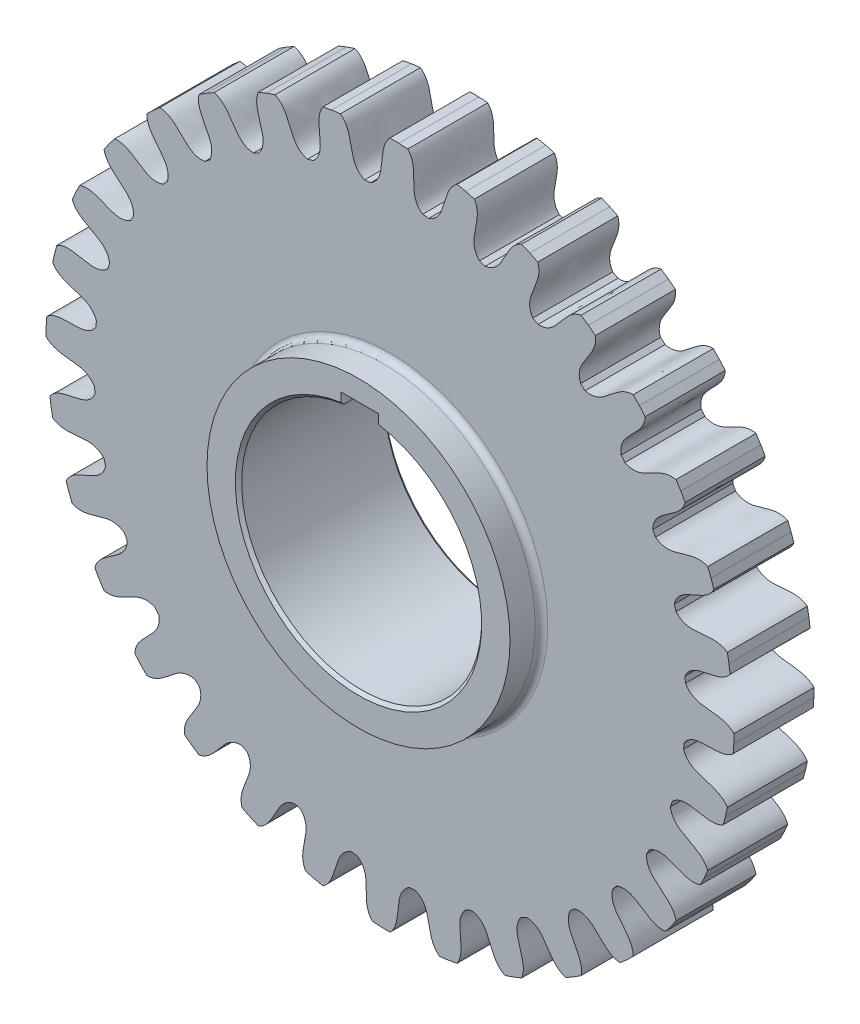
SolidWorks part; units mm, degrees
ref_plane "Ebene vorne" through (0, 0, 0) normal (0, 0, 1) x (1, 0, 0)
ref_plane "Ebene oben" through (0, 0, 0) normal (0, 1, 0) x (1, 0, 0)
ref_plane "Ebene rechts" through (0, 0, 0) normal (1, 0, 0) x (0, 0, -1)
ref_plane "Ebene1" through (0, 0, 13.081) normal (0, 0, 1) x (1, 0, 0)
sketch "Skizze1" plane through (0, 0, 13.081) normal (0, 0, 1) x (1, 0, 0)
  line L0 (22.8551, 51.3844) -> (21.5214, 51.9571)
  line L1 (13.7916, 54.4737) -> (12.3913, 54.8559)
  line L2 (12.3913, 54.8559) -> (10.9715, 55.1574)
  line L3 (2.8993, 56.1176) -> (1.4514, 56.2193)
  line L4 (1.4514, 56.2193) -> (0, 56.238)
  line L5 (-8.1044, 55.6049) -> (-9.5444, 55.4222)
  line L6 (-9.5444, 55.4222) -> (-10.9715, 55.1574)
  line L7 (-18.7967, 52.9554) -> (-20.1733, 52.4952)
  line L8 (-20.1733, 52.4952) -> (-21.5214, 51.9571)
  line L9 (-28.7666, 48.2708) -> (-30.027, 47.5509)
  line L10 (-30.027, 47.5509) -> (-31.2442, 46.7602)
  line L11 (-37.631, 41.7312) -> (-38.7268, 40.7793)
  line L12 (-38.7268, 40.7793) -> (-39.7663, 39.7663)
  line L13 (-45.0493, 33.5879) -> (-45.9383, 32.4405)
  line L14 (-45.9383, 32.4405) -> (-46.7602, 31.2442)
  line L15 (-50.7364, 24.1539) -> (-51.3844, 22.8551)
  line L16 (-51.3844, 22.8551) -> (-51.9571, 21.5214)
  line L17 (-54.4737, 13.7916) -> (-54.8559, 12.3913)
  line L18 (-54.8559, 12.3913) -> (-55.1574, 10.9715)
  line L19 (-56.1176, 2.8993) -> (-56.2193, 1.4514)
  line L20 (-56.2193, 1.4514) -> (-56.238, 0)
  line L21 (-55.6049, -8.1044) -> (-55.4222, -9.5444)
  line L22 (-55.4222, -9.5444) -> (-55.1574, -10.9715)
  line L23 (-52.9554, -18.7967) -> (-52.4952, -20.1733)
  line L24 (-52.4952, -20.1733) -> (-51.9571, -21.5214)
  line L25 (-48.2708, -28.7666) -> (-47.5509, -30.027)
  line L26 (-47.5509, -30.027) -> (-46.7602, -31.2442)
  line L27 (-41.7312, -37.631) -> (-40.7793, -38.7268)
  line L28 (-40.7793, -38.7268) -> (-39.7663, -39.7663)
  line L29 (-33.5879, -45.0493) -> (-32.4405, -45.9383)
  line L30 (-32.4405, -45.9383) -> (-31.2442, -46.7602)
  line L31 (-24.1539, -50.7364) -> (-22.8551, -51.3844)
  line L32 (-22.8551, -51.3844) -> (-21.5214, -51.9571)
  line L33 (-13.7916, -54.4737) -> (-12.3913, -54.8559)
  line L34 (-12.3913, -54.8559) -> (-10.9715, -55.1574)
  line L35 (-2.8993, -56.1176) -> (-1.4514, -56.2193)
  line L36 (-1.4514, -56.2193) -> (0, -56.238)
  line L37 (8.1044, -55.6049) -> (9.5444, -55.4222)
  line L38 (9.5444, -55.4222) -> (10.9715, -55.1574)
  line L39 (18.7967, -52.9554) -> (20.1733, -52.4952)
  line L40 (20.1733, -52.4952) -> (21.5214, -51.9571)
  line L41 (28.7666, -48.2708) -> (30.027, -47.5509)
  line L42 (30.027, -47.5509) -> (31.2442, -46.7602)
  line L43 (37.631, -41.7312) -> (38.7268, -40.7793)
  line L44 (38.7268, -40.7793) -> (39.7663, -39.7663)
  line L45 (45.0493, -33.5879) -> (45.9383, -32.4405)
  line L46 (45.9383, -32.4405) -> (46.7602, -31.2442)
  line L47 (50.7364, -24.1539) -> (51.3844, -22.8551)
  line L48 (51.3844, -22.8551) -> (51.9571, -21.5214)
  line L49 (54.4737, -13.7916) -> (54.8559, -12.3913)
  line L50 (54.8559, -12.3913) -> (55.1574, -10.9715)
  line L51 (56.1176, -2.8993) -> (56.2193, -1.4514)
  line L52 (56.2193, -1.4514) -> (56.238, 0)
  line L53 (55.6049, 8.1044) -> (55.4222, 9.5444)
  line L54 (55.4222, 9.5444) -> (55.1574, 10.9715)
  line L55 (52.9554, 18.7967) -> (52.4952, 20.1733)
  line L56 (52.4952, 20.1733) -> (51.9571, 21.5214)
  line L57 (48.2708, 28.7666) -> (47.5509, 30.027)
  line L58 (47.5509, 30.027) -> (46.7602, 31.2442)
  line L59 (41.7312, 37.631) -> (40.7793, 38.7268)
  line L60 (40.7793, 38.7268) -> (39.7663, 39.7663)
  line L61 (33.5879, 45.0493) -> (32.4405, 45.9383)
  line L62 (32.4405, 45.9383) -> (31.2442, 46.7602)
  line L63 (24.1539, 50.7364) -> (22.8551, 51.3844)
  arc A0 (15.5547, 45.843) -> (14.6243, 46.1482) centre (0, 0) ccw
  arc A1 (6.3123, 47.9967) -> (5.3402, 48.1146) centre (0, 0) ccw
  arc A2 (-3.1727, 48.3059) -> (-4.1491, 48.2319) centre (0, 0) ccw
  arc A3 (-12.5358, 46.7588) -> (-13.4789, 46.4957) centre (0, 0) ccw
  arc A4 (-21.4171, 43.4147) -> (-22.2908, 42.9726) centre (0, 0) ccw
  arc A5 (-29.4753, 38.4022) -> (-30.246, 37.7982) centre (0, 0) ccw
  arc A6 (-36.4009, 31.914) -> (-37.0389, 31.1712) centre (0, 0) ccw
  arc A7 (-41.9276, 24.1993) -> (-42.4084, 23.3463) centre (0, 0) ccw
  arc A8 (-45.843, 15.5547) -> (-46.1482, 14.6243) centre (0, 0) ccw
  arc A9 (-47.9967, 6.3123) -> (-48.1146, 5.3402) centre (0, 0) ccw
  arc A10 (-48.3059, -3.1727) -> (-48.2319, -4.1491) centre (0, 0) ccw
  arc A11 (-46.7588, -12.5358) -> (-46.4957, -13.4789) centre (0, 0) ccw
  arc A12 (-43.4147, -21.4171) -> (-42.9726, -22.2908) centre (0, 0) ccw
  arc A13 (-38.4022, -29.4753) -> (-37.7982, -30.246) centre (0, 0) ccw
  arc A14 (-31.914, -36.4009) -> (-31.1712, -37.0389) centre (0, 0) ccw
  arc A15 (-24.1993, -41.9276) -> (-23.3463, -42.4084) centre (0, 0) ccw
  arc A16 (-15.5547, -45.843) -> (-14.6243, -46.1482) centre (0, 0) ccw
  arc A17 (-6.3123, -47.9967) -> (-5.3402, -48.1146) centre (0, 0) ccw
  arc A18 (3.1727, -48.3059) -> (4.1491, -48.2319) centre (0, 0) ccw
  arc A19 (12.5358, -46.7588) -> (13.4789, -46.4957) centre (0, 0) ccw
  arc A20 (21.4171, -43.4147) -> (22.2908, -42.9726) centre (0, 0) ccw
  arc A21 (29.4753, -38.4022) -> (30.246, -37.7982) centre (0, 0) ccw
  arc A22 (36.4009, -31.914) -> (37.0389, -31.1712) centre (0, 0) ccw
  arc A23 (41.9276, -24.1993) -> (42.4084, -23.3463) centre (0, 0) ccw
  arc A24 (45.843, -15.5547) -> (46.1482, -14.6243) centre (0, 0) ccw
  arc A25 (47.9967, -6.3123) -> (48.1146, -5.3402) centre (0, 0) ccw
  arc A26 (48.3059, 3.1727) -> (48.2319, 4.1491) centre (0, 0) ccw
  arc A27 (46.7588, 12.5358) -> (46.4957, 13.4789) centre (0, 0) ccw
  arc A28 (43.4147, 21.4171) -> (42.9726, 22.2908) centre (0, 0) ccw
  arc A29 (38.4022, 29.4753) -> (37.7982, 30.246) centre (0, 0) ccw
  arc A30 (31.914, 36.4009) -> (31.1712, 37.0389) centre (0, 0) ccw
  arc A31 (24.1993, 41.9276) -> (23.3463, 42.4084) centre (0, 0) ccw
  spline S0 degree 3 poles (15.5547, 45.843) (18.8964, 46.3217) (18.6134, 50.7789) (21.5214, 51.9571) knots 0 0 0 0 1 1 1 1
  spline S1 degree 3 poles (13.7916, 54.4737) (15.4092, 51.8254) (12.3088, 48.5164) (14.6243, 46.1482) knots 0 0 0 0 1 1 1 1
  spline S2 degree 3 poles (6.3123, 47.9967) (9.4964, 49.1181) (8.3493, 53.4345) (10.9715, 55.1574) knots 0 0 0 0 1 1 1 1
  spline S3 degree 3 poles (2.8993, 56.1176) (5.0025, 53.8358) (2.6072, 49.9855) (5.3402, 48.1146) knots 0 0 0 0 1 1 1 1
  spline S4 degree 3 poles (-3.1727, 48.3059) (-0.2685, 50.027) (-2.2357, 54.0366) (0, 56.238) knots 0 0 0 0 1 1 1 1
  spline S5 degree 3 poles (-8.1044, 55.6049) (-5.5965, 53.7773) (-7.1946, 49.5337) (-4.1491, 48.2319) knots 0 0 0 0 1 1 1 1
  spline S6 degree 3 poles (-12.5358, 46.7588) (-10.0231, 49.0134) (-12.7348, 52.5621) (-10.9715, 55.1574) knots 0 0 0 0 1 1 1 1
  spline S7 degree 3 poles (-18.7967, 52.9554) (-15.9804, 51.6522) (-16.7199, 47.1783) (-13.4789, 46.4957) knots 0 0 0 0 1 1 1 1
  spline S8 degree 3 poles (-21.4171, 43.4147) (-19.3926, 46.1162) (-22.7445, 49.0677) (-21.5214, 51.9571) knots 0 0 0 0 1 1 1 1
  spline S9 degree 3 poles (-28.7666, 48.2708) (-25.7502, 47.5421) (-25.6027, 43.0099) (-22.2908, 42.9726) knots 0 0 0 0 1 1 1 1
  spline S10 degree 3 poles (-29.4753, 38.4022) (-28.0168, 41.4468) (-31.8801, 43.6877) (-31.2442, 46.7602) knots 0 0 0 0 1 1 1 1
  spline S11 degree 3 poles (-37.631, 41.7312) (-34.5304, 41.6049) (-33.5015, 37.1886) (-30.246, 37.7982) knots 0 0 0 0 1 1 1 1
  spline S12 degree 3 poles (-36.4009, 31.914) (-35.5643, 35.1846) (-39.7906, 36.6288) (-39.7663, 39.7663) knots 0 0 0 0 1 1 1 1
  spline S13 degree 3 poles (-45.0493, 33.5879) (-41.9836, 34.069) (-40.1129, 29.9382) (-37.0389, 31.1712) knots 0 0 0 0 1 1 1 1
  spline S14 degree 3 poles (-41.9276, 24.1993) (-41.7451, 27.5703) (-46.1719, 28.1622) (-46.7602, 31.2442) knots 0 0 0 0 1 1 1 1
  spline S15 degree 3 poles (-50.7364, 24.1539) (-47.8235, 25.2237) (-45.1828, 21.5373) (-42.4084, 23.3463) knots 0 0 0 0 1 1 1 1
  spline S16 degree 3 poles (-45.843, 15.5547) (-46.3217, 18.8964) (-50.7789, 18.6134) (-51.9571, 21.5214) knots 0 0 0 0 1 1 1 1
  spline S17 degree 3 poles (-54.4737, 13.7916) (-51.8254, 15.4092) (-48.5164, 12.3088) (-46.1482, 14.6243) knots 0 0 0 0 1 1 1 1
  spline S18 degree 3 poles (-47.9967, 6.3123) (-49.1181, 9.4964) (-53.4345, 8.3493) (-55.1574, 10.9715) knots 0 0 0 0 1 1 1 1
  spline S19 degree 3 poles (-56.1176, 2.8993) (-53.8358, 5.0025) (-49.9855, 2.6072) (-48.1146, 5.3402) knots 0 0 0 0 1 1 1 1
  spline S20 degree 3 poles (-48.3059, -3.1727) (-50.027, -0.2685) (-54.0366, -2.2357) (-56.238, 0) knots 0 0 0 0 1 1 1 1
  spline S21 degree 3 poles (-55.6049, -8.1044) (-53.7773, -5.5965) (-49.5337, -7.1946) (-48.2319, -4.1491) knots 0 0 0 0 1 1 1 1
  spline S22 degree 3 poles (-46.7588, -12.5358) (-49.0134, -10.0231) (-52.5621, -12.7348) (-55.1574, -10.9715) knots 0 0 0 0 1 1 1 1
  spline S23 degree 3 poles (-52.9554, -18.7967) (-51.6522, -15.9804) (-47.1783, -16.7199) (-46.4957, -13.4789) knots 0 0 0 0 1 1 1 1
  spline S24 degree 3 poles (-43.4147, -21.4171) (-46.1162, -19.3926) (-49.0677, -22.7445) (-51.9571, -21.5214) knots 0 0 0 0 1 1 1 1
  spline S25 degree 3 poles (-48.2708, -28.7666) (-47.5421, -25.7502) (-43.0099, -25.6027) (-42.9726, -22.2908) knots 0 0 0 0 1 1 1 1
  spline S26 degree 3 poles (-38.4022, -29.4753) (-41.4468, -28.0168) (-43.6877, -31.8801) (-46.7602, -31.2442) knots 0 0 0 0 1 1 1 1
  spline S27 degree 3 poles (-41.7312, -37.631) (-41.6049, -34.5304) (-37.1886, -33.5015) (-37.7982, -30.246) knots 0 0 0 0 1 1 1 1
  spline S28 degree 3 poles (-31.914, -36.4009) (-35.1846, -35.5643) (-36.6288, -39.7906) (-39.7663, -39.7663) knots 0 0 0 0 1 1 1 1
  spline S29 degree 3 poles (-33.5879, -45.0493) (-34.069, -41.9836) (-29.9382, -40.1129) (-31.1712, -37.0389) knots 0 0 0 0 1 1 1 1
  spline S30 degree 3 poles (-24.1993, -41.9276) (-27.5703, -41.7451) (-28.1622, -46.1719) (-31.2442, -46.7602) knots 0 0 0 0 1 1 1 1
  spline S31 degree 3 poles (-24.1539, -50.7364) (-25.2237, -47.8235) (-21.5373, -45.1828) (-23.3463, -42.4084) knots 0 0 0 0 1 1 1 1
  spline S32 degree 3 poles (-15.5547, -45.843) (-18.8964, -46.3217) (-18.6134, -50.7789) (-21.5214, -51.9571) knots 0 0 0 0 1 1 1 1
  spline S33 degree 3 poles (-13.7916, -54.4737) (-15.4092, -51.8254) (-12.3088, -48.5164) (-14.6243, -46.1482) knots 0 0 0 0 1 1 1 1
  spline S34 degree 3 poles (-6.3123, -47.9967) (-9.4964, -49.1181) (-8.3493, -53.4345) (-10.9715, -55.1574) knots 0 0 0 0 1 1 1 1
  spline S35 degree 3 poles (-2.8993, -56.1176) (-5.0025, -53.8358) (-2.6072, -49.9855) (-5.3402, -48.1146) knots 0 0 0 0 1 1 1 1
  spline S36 degree 3 poles (3.1727, -48.3059) (0.2685, -50.027) (2.2357, -54.0366) (0, -56.238) knots 0 0 0 0 1 1 1 1
  spline S37 degree 3 poles (8.1044, -55.6049) (5.5965, -53.7773) (7.1946, -49.5337) (4.1491, -48.2319) knots 0 0 0 0 1 1 1 1
  spline S38 degree 3 poles (12.5358, -46.7588) (10.0231, -49.0134) (12.7348, -52.5621) (10.9715, -55.1574) knots 0 0 0 0 1 1 1 1
  spline S39 degree 3 poles (18.7967, -52.9554) (15.9804, -51.6522) (16.7199, -47.1783) (13.4789, -46.4957) knots 0 0 0 0 1 1 1 1
  spline S40 degree 3 poles (21.4171, -43.4147) (19.3926, -46.1162) (22.7445, -49.0677) (21.5214, -51.9571) knots 0 0 0 0 1 1 1 1
  spline S41 degree 3 poles (28.7666, -48.2708) (25.7502, -47.5421) (25.6027, -43.0099) (22.2908, -42.9726) knots 0 0 0 0 1 1 1 1
  spline S42 degree 3 poles (29.4753, -38.4022) (28.0168, -41.4468) (31.8801, -43.6877) (31.2442, -46.7602) knots 0 0 0 0 1 1 1 1
  spline S43 degree 3 poles (37.631, -41.7312) (34.5304, -41.6049) (33.5015, -37.1886) (30.246, -37.7982) knots 0 0 0 0 1 1 1 1
  spline S44 degree 3 poles (36.4009, -31.914) (35.5643, -35.1846) (39.7906, -36.6288) (39.7663, -39.7663) knots 0 0 0 0 1 1 1 1
  spline S45 degree 3 poles (45.0493, -33.5879) (41.9836, -34.069) (40.1129, -29.9382) (37.0389, -31.1712) knots 0 0 0 0 1 1 1 1
  spline S46 degree 3 poles (41.9276, -24.1993) (41.7451, -27.5703) (46.1719, -28.1622) (46.7602, -31.2442) knots 0 0 0 0 1 1 1 1
  spline S47 degree 3 poles (50.7364, -24.1539) (47.8235, -25.2237) (45.1828, -21.5373) (42.4084, -23.3463) knots 0 0 0 0 1 1 1 1
  spline S48 degree 3 poles (45.843, -15.5547) (46.3217, -18.8964) (50.7789, -18.6134) (51.9571, -21.5214) knots 0 0 0 0 1 1 1 1
  spline S49 degree 3 poles (54.4737, -13.7916) (51.8254, -15.4092) (48.5164, -12.3088) (46.1482, -14.6243) knots 0 0 0 0 1 1 1 1
  spline S50 degree 3 poles (47.9967, -6.3123) (49.1181, -9.4964) (53.4345, -8.3493) (55.1574, -10.9715) knots 0 0 0 0 1 1 1 1
  spline S51 degree 3 poles (56.1176, -2.8993) (53.8358, -5.0025) (49.9855, -2.6072) (48.1146, -5.3402) knots 0 0 0 0 1 1 1 1
  spline S52 degree 3 poles (48.3059, 3.1727) (50.027, 0.2685) (54.0366, 2.2357) (56.238, 0) knots 0 0 0 0 1 1 1 1
  spline S53 degree 3 poles (55.6049, 8.1044) (53.7773, 5.5965) (49.5337, 7.1946) (48.2319, 4.1491) knots 0 0 0 0 1 1 1 1
  spline S54 degree 3 poles (46.7588, 12.5358) (49.0134, 10.0231) (52.5621, 12.7348) (55.1574, 10.9715) knots 0 0 0 0 1 1 1 1
  spline S55 degree 3 poles (52.9554, 18.7967) (51.6522, 15.9804) (47.1783, 16.7199) (46.4957, 13.4789) knots 0 0 0 0 1 1 1 1
  spline S56 degree 3 poles (43.4147, 21.4171) (46.1162, 19.3926) (49.0677, 22.7445) (51.9571, 21.5214) knots 0 0 0 0 1 1 1 1
  spline S57 degree 3 poles (48.2708, 28.7666) (47.5421, 25.7502) (43.0099, 25.6027) (42.9726, 22.2908) knots 0 0 0 0 1 1 1 1
  spline S58 degree 3 poles (38.4022, 29.4753) (41.4468, 28.0168) (43.6877, 31.8801) (46.7602, 31.2442) knots 0 0 0 0 1 1 1 1
  spline S59 degree 3 poles (41.7312, 37.631) (41.6049, 34.5304) (37.1886, 33.5015) (37.7982, 30.246) knots 0 0 0 0 1 1 1 1
  spline S60 degree 3 poles (31.914, 36.4009) (35.1846, 35.5643) (36.6288, 39.7906) (39.7663, 39.7663) knots 0 0 0 0 1 1 1 1
  spline S61 degree 3 poles (33.5879, 45.0493) (34.069, 41.9836) (29.9382, 40.1129) (31.1712, 37.0389) knots 0 0 0 0 1 1 1 1
  spline S62 degree 3 poles (24.1993, 41.9276) (27.5703, 41.7451) (28.1622, 46.1719) (31.2442, 46.7602) knots 0 0 0 0 1 1 1 1
  spline S63 degree 3 poles (24.1539, 50.7364) (25.2237, 47.8235) (21.5373, 45.1828) (23.3463, 42.4084) knots 0 0 0 0 1 1 1 1
extrude "Aufsatz-Linear austragen1" add sketch "Skizze1" against normal blind 13.081
sketch "Skizze2" plane through (0, 0, 13.081) normal (0, 0, 1) x (1, 0, 0)
  circle A0 centre (0, 0) radius 24.7715
extrude "Aufsatz-Linear austragen2" add sketch "Skizze2" along normal blind 5.15
sketch "Skizze3" plane through (0, 0, 0) normal (0, 0, -1) x (-1, 0, 0)
  circle A0 centre (0, 0) radius 24.7715
extrude "Aufsatz-Linear austragen3" add sketch "Skizze3" along normal blind 6.18
sketch "Skizze4" plane through (0, 0, -6.18) normal (0, 0, -1) x (-1, 0, 0)
  line L0 (2.898, 21.4051) -> (-3.282, 21.4051)
  line L1 (-3.282, 21.4051) -> (-3.282, 19.3451)
  line L2 (2.898, 19.4063) -> (2.898, 21.4051)
  arc A0 (-3.282, 19.3451) -> (2.898, 19.4063) centre (0, 0) cw
extrude "Schnitt-Linear austragen1" cut sketch "Skizze4" against normal through all
sketch "Skizze5" plane through (0, 0, 0) normal (0, 1, 0) x (1, 0, 0)
  line L0 (19.6215, 6.18) -> (0, 6.18)
  line L1 (0, 6.18) -> (0, -18.231)
  line L2 (0, -18.231) -> (19.6215, -18.231)
  line L3 (19.6215, -18.231) -> (19.6215, 6.18)
  line L4 (0, 6.18) -> (0, -18.231) construction
revolve "Schnitt-Rotation1" cut sketch "Skizze5" angle 360 about L4
chamfer "Fase1" distance 0.515 angle 45 2 edges at (-0.1944, -19.6205, 18.231) (-0.1944, -19.6205, -6.18)
fillet "Zahnrad" radius 1.03 2 edges at (-24.7715, 0, 0) (-24.7715, 0, 13.081)
